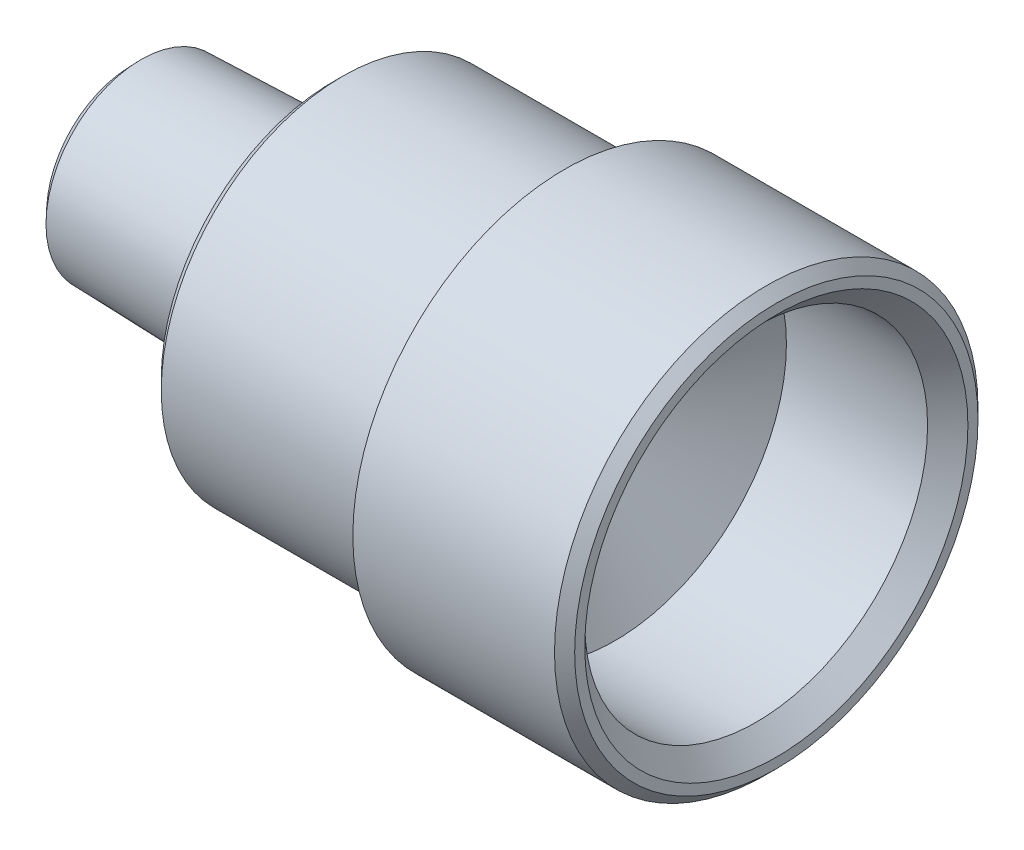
SolidWorks part; units mm, degrees
ref_plane "Face" through (0, 0, 0) normal (0, 0, 1) x (1, 0, 0)
ref_plane "Dessus" through (0, 0, 0) normal (0, 1, 0) x (1, 0, 0)
ref_plane "Droite" through (0, 0, 0) normal (1, 0, 0) x (0, 0, -1)
sketch "Esquisse1" plane through (0, 0, 0) normal (0, 0, 1) x (1, 0, 0)
  line L0 (0, 3) -> (0, 4.7)
  line L1 (0, 4.7) -> (10, 5)
  line L2 (10, 5) -> (10, 9)
  line L3 (10, 9) -> (20.634, 9)
  line L4 (20.634, 9) -> (21.5, 10.5)
  line L5 (21.5, 10.5) -> (32, 10.5)
  line L6 (32, 10.5) -> (32, 8.5)
  line L7 (32, 8.5) -> (24, 8.5)
  line L8 (24, 8.5) -> (20.6269, 2.6577)
  line L9 (20.6269, 3) -> (0, 3)
  line L10 (20.6269, 2.6577) -> (20.6269, 3)
  line L11 (-9.133, 0) -> (36.6439, 0) construction
  dimension "D1" = 3
  dimension "D2" = 4.7
  dimension "D3" = 10
  dimension "D4" = 22
  dimension "D5" = 10.5
  dimension "D6" = 2
  dimension "D7" = 9
  dimension "D8" = 5
  dimension "D9" = 10.5
  dimension "D10" = 120
  dimension "D11" = 8
  dimension "D12" = 120
revolve "Base-Révolution" add sketch "Esquisse1" angle 360 about L11
chamfer "Chanfrein1" distance 0.5 angle 45
chamfer "Chanfrein2" distance 1 angle 45
sketch "Esquisse2" plane through (0, 0, 0) normal (1, 0, 0) x (0, 0, -1)
  line L1 (-1.7321, 3) -> (-3.4641, 0)
  line L2 (-3.4641, 0) -> (-1.7321, -3)
  line L3 (-1.7321, -3) -> (1.7321, -3)
  line L4 (1.7321, -3) -> (3.4641, 0)
  line L5 (3.4641, 0) -> (1.7321, 3)
  line L6 (1.7321, 3) -> (-1.7321, 3)
  circle A0 centre (0, 0) radius 3 construction
extrude "Enlèv. mat.-Extru.1" cut sketch "Esquisse2" along normal through all
